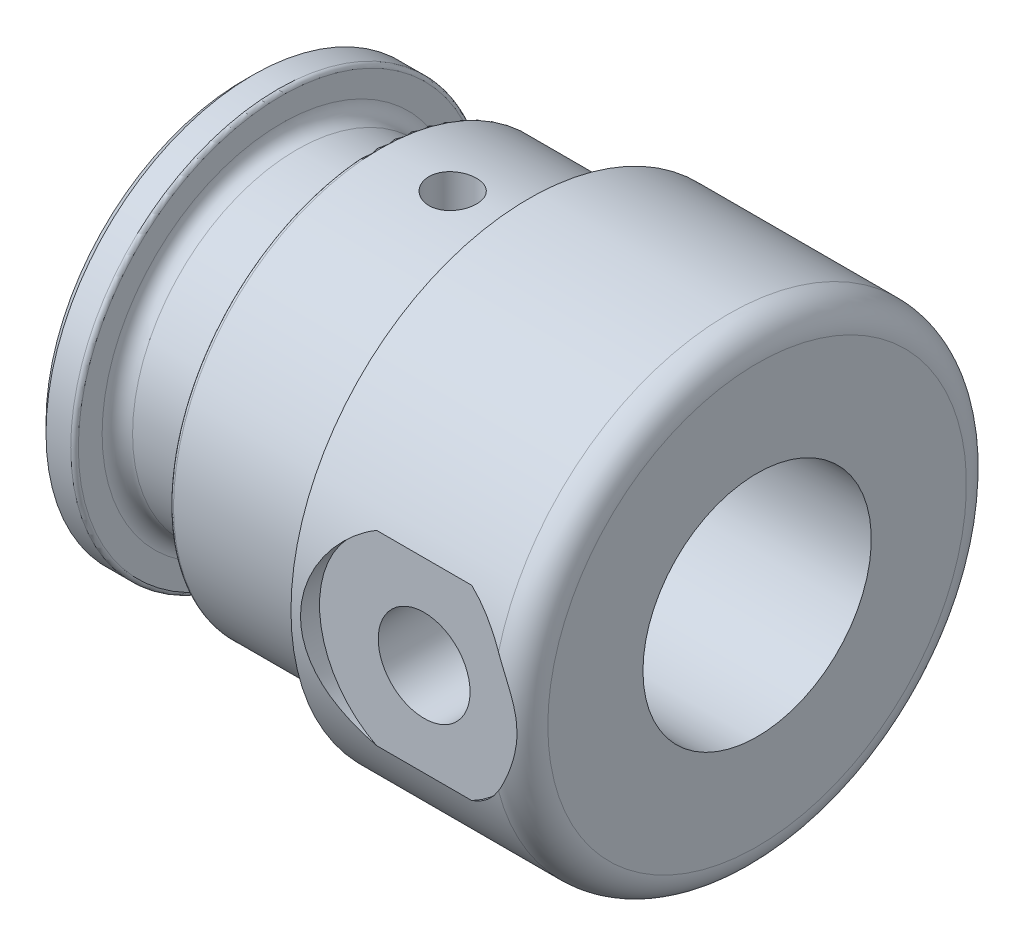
SolidWorks part; units mm, degrees
ref_plane "Plane1" through (0, 0, 0) normal (0, 0, 1) x (1, 0, 0)
ref_plane "Plane2" through (0, 0, 0) normal (0, 1, 0) x (1, 0, 0)
ref_plane "Plane3" through (0, 0, 0) normal (1, 0, 0) x (0, 0, -1)
sketch "Sketch1" plane through (0, 0, 0) normal (0, 0, 1) x (1, 0, 0)
  line L0 (0, 0) -> (60, 0) construction
  line L6 (0, 5.5562) -> (0, 10.875)
  line L10 (2, 8.625) -> (7, 8.625)
  line L13 (2, 10.875) -> (2, 8.625)
  line L15 (7, 8.625) -> (7, 10.875)
  line L16 (7, 10.875) -> (15, 10.875)
  line L22 (0, 10.875) -> (2, 10.875)
  line L23 (15, 10.875) -> (15, 12.5)
  line L24 (15, 12.5) -> (27, 12.5)
  line L25 (27, 12.5) -> (27, 5.5563)
  line L26 (27, 5.5563) -> (0, 5.5562)
  dimension "D2" = 17.25
  dimension "D3" = 2
  dimension "D4" = 21.75
  dimension "D5" = 15
  dimension "D7" = 5
  dimension "D12" = 12
  dimension "D13" = 25
  dimension "D14" = 11.1125
revolve "Base-Revolve" add sketch "Sketch1" angle 360 about L0
chamfer "Chamfer1" distance 0.5 angle 45 1 edges at (0, 0, 10.875)
ref_plane "Plane4" through (0, 11.125, 0) normal (0, 1, 0) x (-1, 0, 0)
hole_wizard "M3x0.5 Tapped Hole1" positions "Sketch9" profile "Sketch8" tap size "M3x0.5" standard "Ansi Metric"
sketch "Sketch9" plane through (0, 11.125, 0) normal (0, 1, 0) x (-1, 0, 0)
  line L0 (0, 0) -> (-60, 0) construction
  line L1 (-15, -12.5) -> (-15, 12.5) construction
  point P0 (-11, 0)
  dimension "D1" = 4
sketch "Sketch8" plane through (11, 11.125, 0) normal (1, 0, 0) x (0, 0, 1)
  line L0 (0, 0) -> (0, 4.7511)
  line L1 (0, 4.7511) -> (1.25, 4)
  line L2 (1.25, 4) -> (1.25, 0)
  line L5 (1.25, 0) -> (0, 0)
  line L10 (0, 4.7511) -> (-1.25, 4) construction
  line L11 (0, -6.35) -> (0, 107.95) construction
  dimension "Tap Drill Dia." = 2.5
  dimension "Tap Drill Depth" = 4
  dimension "Drill Angle" = 118
fillet "Fillet1" radius 1.5 1 edges at (27, 0, 12.5)
fillet "Fillet2" radius 0.8 2 edges at (2, 0, 8.625) (7, 0, 8.625)
fillet "Fillet3" radius 0.2 2 edges at (2, 0, 10.875) (7, 0, 10.875)
pattern_circular "CirPattern1" count 2 over 360 about axis through (0, 0, 0) along (1, 0, 0) of "M3x0.5 Tapped Hole1"
sketch "Sketch10" plane through (0, 0, 0) normal (-1, 0, 0) x (0, 0, 1)
  circle A0 centre (0, 0) radius 6
  dimension "D1" = 12
extrude "Cut-Extrude1" cut sketch "Sketch10" against normal blind 27
ref_plane "Plane5" through (0, 0, 13) normal (0, 0, 1) x (1, 0, 0)
sketch "Sketch11" plane through (0, 0, 13) normal (0, 0, 1) x (1, 0, 0)
  line L0 (27, 0) -> (0, 0) construction
  line L1 (27, -11) -> (27, 11) construction
  circle A0 centre (21, 0) radius 5.5
  dimension "D1" = 11
  dimension "D2" = 6
extrude "Cut-Extrude2" cut sketch "Sketch11" against normal blind 1.5
ref_plane "Plane6" through (0, 0, 2.5) normal (0, 0, 1) x (1, 0, 0)
hole_wizard "#10-32 Tapped Hole1" positions "Sketch13" profile "Sketch12" tap size "#10-32" standard "Ansi Inch"
sketch "Sketch13" plane through (0, 0, 11.5) normal (0, 0, 1) x (1, 0, 0)
  arc A0 (25.5, -3.1623) -> (25.5, 3.1623) centre (21, 0) ccw construction
  point P0 (21, 0)
sketch "Sketch12" plane through (21, 0, 11.5) normal (1, 0, 0) x (0, -1, 0)
  line L0 (0, 0) -> (0, 15.1757)
  line L1 (0, 15.1757) -> (2.0193, 13.9624)
  line L2 (2.0193, 13.9624) -> (2.0193, 10)
  line L3 (2.0193, 10) -> (2.413, 10)
  line L4 (2.413, 10) -> (2.413, 0)
  line L5 (2.413, 0) -> (0, 0)
  line L10 (0, 15.1757) -> (-2.0193, 13.9624) construction
  line L11 (0, -6.35) -> (0, 107.95) construction
  dimension "Tap Drill Dia." = 4.0386
  dimension "Tap Drill Depth" = 13.9624
  dimension "Thread Major Dia." = 4.826
  dimension "Thread Depth" = 10
  dimension "Drill Angle" = 118
